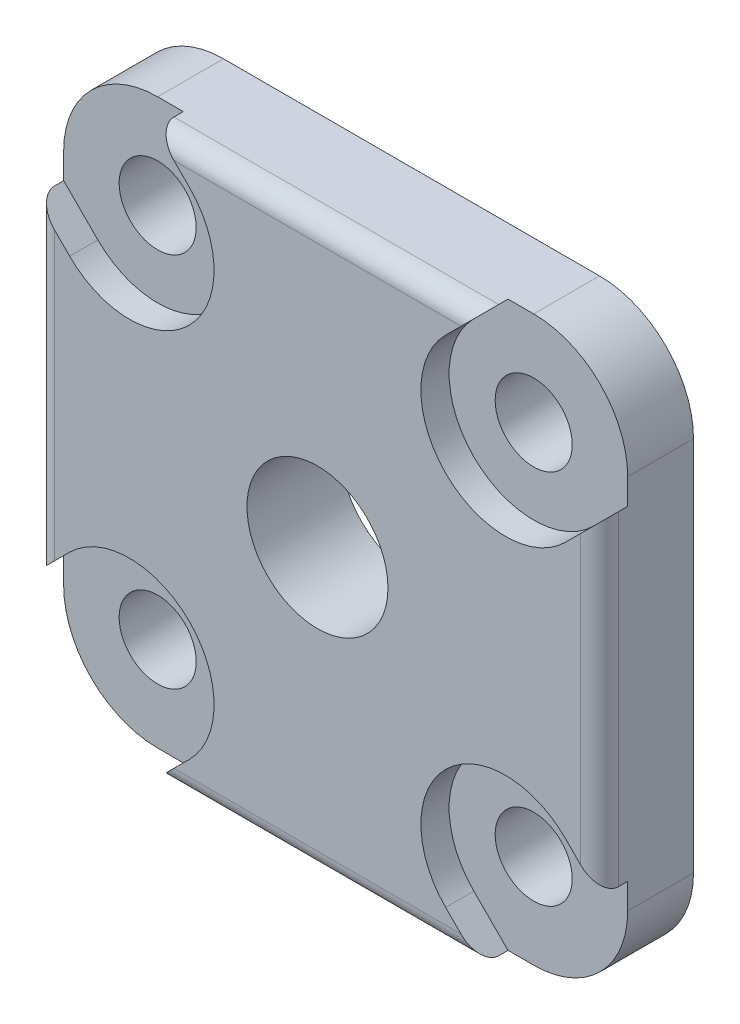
SolidWorks part; units mm, degrees
ref_plane "Front" through (0, 0, 0) normal (0, 0, 1) x (1, 0, 0)
ref_plane "Top" through (0, 0, 0) normal (0, 1, 0) x (1, 0, 0)
ref_plane "Right" through (0, 0, 0) normal (1, 0, 0) x (0, 0, -1)
sketch "Sketch2" plane through (0, 0, 0) normal (0, 0, 1) x (1, 0, 0)
  line L1 (-20, 30) -> (20, 30)
  line L2 (-30, 20) -> (-30, -20)
  line L3 (-20, -30) -> (20, -30)
  line L4 (30, 20) -> (30, -20)
  line L5 (-30, 30) -> (30, -30) construction
  line L6 (-30, -30) -> (30, 30) construction
  arc A0 (-30, -20) -> (-20, -30) centre (-20, -20) ccw
  arc A1 (30, -20) -> (20, -30) centre (20, -20) cw
  arc A2 (30, 20) -> (20, 30) centre (20, 20) ccw
  arc A3 (-30, 20) -> (-20, 30) centre (-20, 20) cw
  point P0 (0, 0)
  dimension "D2" = 10
  dimension "D1" = 60
extrude "Boss-Extrude1" add sketch "Sketch2" along normal mid plane 10
sketch "Sketch3" plane through (0, 0, 5) normal (0, 0, 1) x (1, 0, 0)
  circle A0 centre (0, 0) radius 7.5
  dimension "D1" = 15
extrude "Cut-Extrude1" cut sketch "Sketch3" against normal blind 10
hole_wizard "Ø8.2 (8.2) Diameter Hole1" positions "Sketch5" profile "Sketch6" hole size "Ø8.2" standard "ANSI Metric"
sketch "Sketch5" plane through (0, 0, -5) normal (0, 0, -1) x (-1, 0, 0)
  arc A0 (-20, 30) -> (-30, 20) centre (-20, 20) ccw construction
  arc A1 (30, 20) -> (20, 30) centre (20, 20) ccw construction
  arc A2 (-30, -20) -> (-20, -30) centre (-20, -20) ccw construction
  arc A3 (20, -30) -> (30, -20) centre (20, -20) ccw construction
  point P0 (-20, 20)
  point P2 (20, 20)
  point P4 (20, -20)
  point P6 (-20, -20)
sketch "Sketch6" plane through (20, 20, -5) normal (1, 0, 0) x (0, 1, 0)
  line L0 (0, 0) -> (0, 10)
  line L1 (0, 10) -> (4.1, 10)
  line L2 (4.1, 10) -> (4.1, 0)
  line L5 (4.1, 0) -> (0, 0)
  line L11 (0, -6.35) -> (0, 107.95) construction
  dimension "Thru Hole Dia." = 8.2
  dimension "Thru Hole Depth" = 10
sketch "Sketch9" plane through (0, 0, 5) normal (0, 0, -1) x (-1, 0, 0)
  line L0 (-20, 20) -> (-27.0711, 27.0711) construction
  line L2 (-13.636, 26.364) -> (-17.2721, 30)
  line L4 (-30, 17.2721) -> (-26.364, 13.636)
  line L5 (-30, -20) -> (-30, 20) construction
  line L6 (-20, 30) -> (20, 30) construction
  line L7 (-30, 17.2721) -> (-30, 20)
  line L8 (-20, 30) -> (-17.2721, 30)
  arc A0 (-26.364, 13.636) -> (-13.636, 26.364) centre (-20, 20) ccw
  circle A1 centre (-20, 20) radius 4.1 construction
  arc A2 (-20, 30) -> (-30, 20) centre (-20, 20) ccw construction
  arc A3 (-20, 30) -> (-30, 20) centre (-20, 20) ccw
  dimension "D1" = 18
extrude "Cut-Extrude2" cut sketch "Sketch9" along normal blind 3
mirror "Mirror1" about plane through (0, 0, 0) normal (0, 1, 0) of "Cut-Extrude2"
mirror "Mirror2" about plane through (0, 0, 0) normal (1, 0, 0) of "Mirror1", "Cut-Extrude2"
fillet "Fillet1" radius 2 4 edges at (-30, 0, 5) (0, -30, 5) (30, 0, 5) (0, 30, 5)
